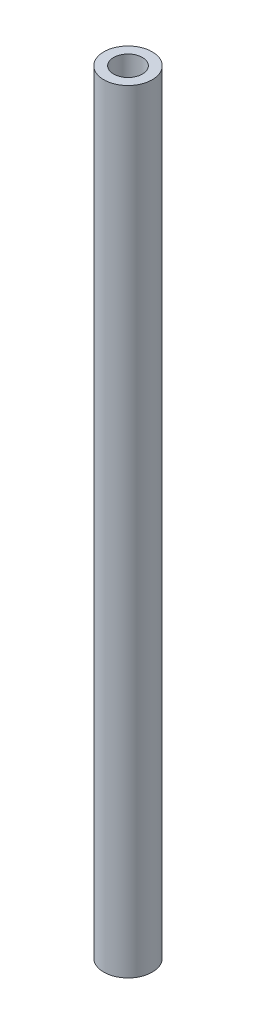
SolidWorks part; units mm, degrees
ref_plane "Front Plane" through (0, 0, 0) normal (0, 0, 1) x (1, 0, 0)
ref_plane "Top Plane" through (0, 0, 0) normal (0, 1, 0) x (1, 0, 0)
ref_plane "Right Plane" through (0, 0, 0) normal (1, 0, 0) x (0, 0, -1)
sketch "Sketch1" plane through (0, 0, 0) normal (0, 1, 0) x (1, 0, 0)
  circle A0 centre (0, 0) radius 2.3876
  dimension "D1" = 4.7752
extrude "Extrude1" add sketch "Sketch1" along normal blind 76.2
hole_wizard "#4-40 Tapped Hole1" positions "3DSketch1" profile "Sketch2" tap size "#4-40" standard "Ansi Inch"
sketch3d "3DSketch1"
  line L0 (0, 76.2, 0) -> (0, 0, 0) construction
  point P0 (0, 76.2, 0)
sketch "Sketch2" plane through (0, 76.2, 0) normal (1, 0, 0) x (0, 0, 1)
  line L0 (0, 0) -> (0, 13.6332)
  line L1 (0, 13.6332) -> (1.1303, 12.954)
  line L2 (1.1303, 12.954) -> (1.1303, 9.652)
  line L3 (1.1303, 9.652) -> (1.4224, 9.652)
  line L4 (1.4224, 9.652) -> (1.4224, 0)
  line L5 (1.4224, 0) -> (0, 0)
  line L10 (0, 13.6332) -> (-1.1303, 12.954) construction
  line L11 (0, -6.35) -> (0, 107.95) construction
  dimension "Tap Drill Dia." = 2.2606
  dimension "Tap Drill Depth" = 12.954
  dimension "Thread Major Dia." = 2.8448
  dimension "Thread Depth" = 9.652
  dimension "Drill Angle" = 118
